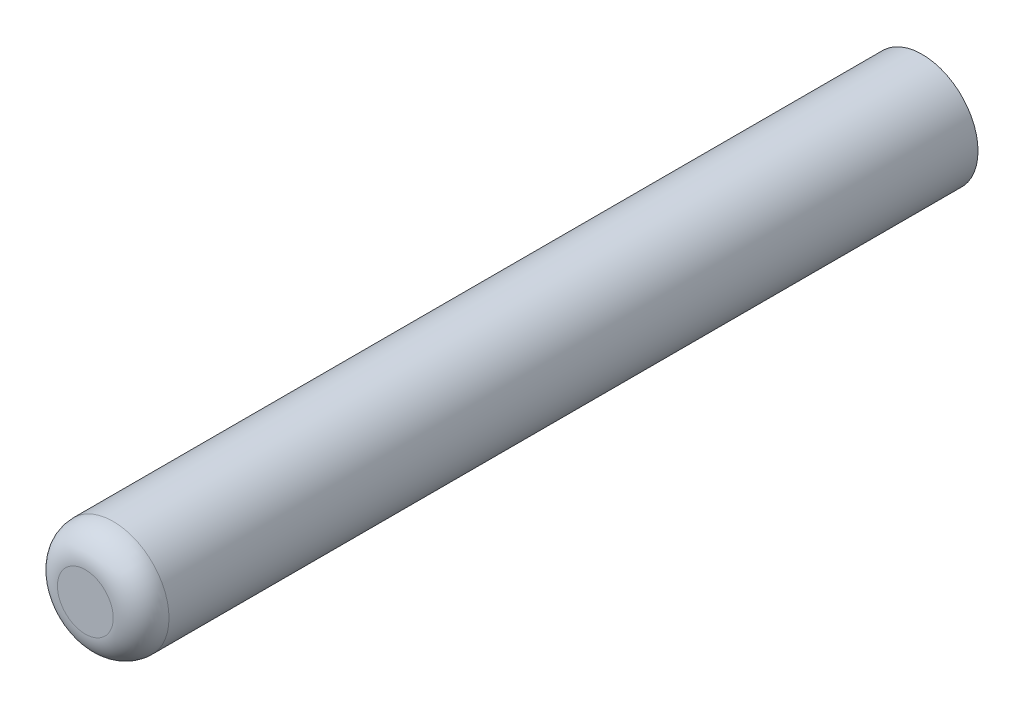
SolidWorks part; units mm, degrees
ref_plane "Face" through (0, 0, 0) normal (0, 0, 1) x (1, 0, 0)
ref_plane "Dessus" through (0, 0, 0) normal (0, 1, 0) x (1, 0, 0)
ref_plane "Droite" through (0, 0, 0) normal (1, 0, 0) x (0, 0, -1)
sketch "Esquisse1" plane through (0, 0, 0) normal (0, 0, 1) x (1, 0, 0)
  circle A0 centre (0, 0) radius 1
  dimension "D1" = 2
extrude "Cylindre de base" add sketch "Esquisse1" along normal mid plane 15
fillet "Congé1" radius 0.5
